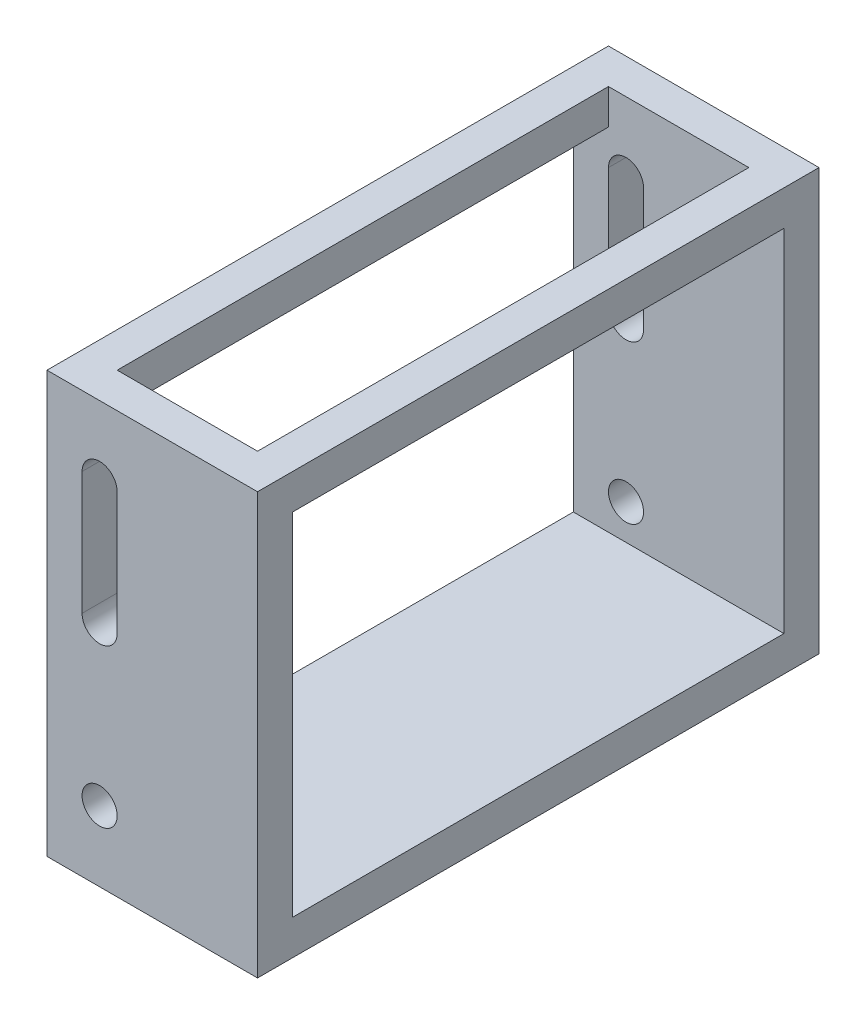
SolidWorks part; units mm, degrees
ref_plane "Front Plane" through (0, 0, 0) normal (0, 0, 1) x (1, 0, 0)
ref_plane "Top Plane" through (0, 0, 0) normal (0, 1, 0) x (1, 0, 0)
ref_plane "Right Plane" through (0, 0, 0) normal (1, 0, 0) x (0, 0, -1)
sketch "Sketch1" plane through (0, 0, 0) normal (0, 1, 0) x (1, 0, 0)
  line L1 (0, 0) -> (76.2, 0)
  line L2 (0, 0) -> (0, 203.2)
  line L3 (0, 203.2) -> (76.2, 203.2)
  line L4 (76.2, 0) -> (76.2, 203.2)
  dimension "D1" = 203.2
  dimension "D2" = 76.2
extrude "Boss-Extrude1" add sketch "Sketch1" along normal blind 12.7
sketch "Sketch2" plane through (0, 12.7, 0) normal (0, 1, 0) x (1, 0, 0)
  line L0 (76.2, 0) -> (76.2, 203.2) construction
  line L1 (0, 203.2) -> (76.2, 203.2)
  line L2 (0, 203.2) -> (0, 190.5)
  line L3 (0, 190.5) -> (76.2, 190.5)
  line L4 (76.2, 203.2) -> (76.2, 190.5)
  line L5 (0, 203.2) -> (0, 0) construction
  line L6 (76.2, 0) -> (0, 0)
  line L7 (76.2, 0) -> (76.2, 12.7)
  line L8 (76.2, 12.7) -> (0, 12.7)
  line L9 (0, 0) -> (0, 12.7)
  dimension "D1" = 12.7
  dimension "D2" = 12.7
extrude "Boss-Extrude2" add sketch "Sketch2" along normal blind 127
sketch "Sketch3" plane through (0, 139.7, 0) normal (0, 1, 0) x (1, 0, 0)
  line L0 (0, 203.2) -> (0, 0)
  line L1 (0, 0) -> (76.2, 0)
  line L2 (76.2, 0) -> (76.2, 203.2)
  line L3 (76.2, 203.2) -> (0, 203.2)
  line L4 (0, 190.5) -> (76.2, 190.5) construction
  line L5 (12.7, 190.5) -> (63.5, 190.5)
  line L6 (12.7, 190.5) -> (12.7, 12.7)
  line L7 (12.7, 12.7) -> (63.5, 12.7)
  line L8 (63.5, 190.5) -> (63.5, 12.7)
  line L9 (76.2, 12.7) -> (0, 12.7) construction
  dimension "D1" = 12.7
  dimension "D2" = 12.7
extrude "Boss-Extrude3" add sketch "Sketch3" along normal blind 12.7
sketch "Sketch4" plane through (0, 0, 0) normal (0, 0, 1) x (1, 0, 0)
  line L0 (0, 152.4) -> (0, 0) construction
  line L1 (0, 152.4) -> (76.2, 152.4) construction
  line L2 (0, 0) -> (76.2, 0) construction
  line L3 (12.7, 127) -> (12.7, 82.55)
  line L4 (25.4, 127) -> (25.4, 82.55)
  arc A0 (25.4, 127) -> (12.7, 127) centre (19.05, 127) ccw
  arc A1 (12.7, 82.55) -> (25.4, 82.55) centre (19.05, 82.55) ccw
  circle A2 centre (19.05, 25.4) radius 6.35
  dimension "D1" = 12.7
  dimension "D2" = 19.05
  dimension "D3" = 25.4
  dimension "D4" = 25.4
  dimension "D5" = 44.45
extrude "Cut-Extrude1" cut sketch "Sketch4" against normal through all
